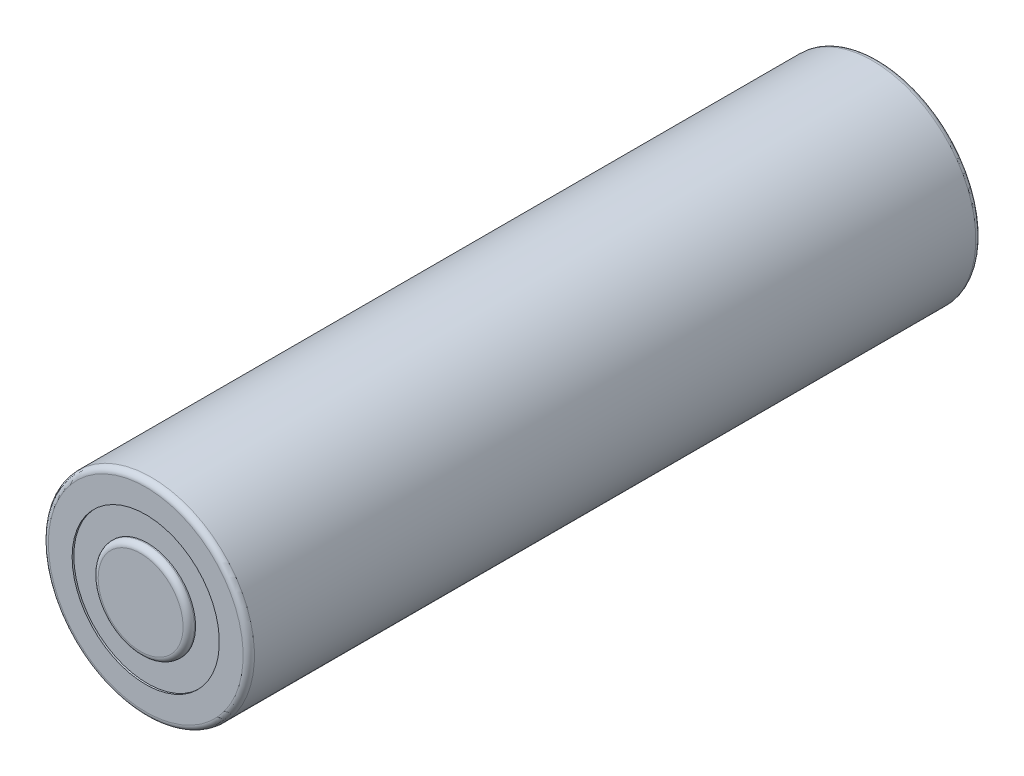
SolidWorks part; units mm, degrees
ref_plane "Front Plane" through (0, 0, 0) normal (0, 0, 1) x (1, 0, 0)
ref_plane "Top Plane" through (0, 0, 0) normal (0, 1, 0) x (1, 0, 0)
ref_plane "Right Plane" through (0, 0, 0) normal (1, 0, 0) x (0, 0, -1)
ref_plane "Plane1" through (0, 15.272, 0) normal (0, -1, 0) x (1, 0, 0)
sketch "Sketch1" plane through (0, 15.272, 0) normal (0, -1, 0) x (1, 0, 0)
  line L0 (-25.1244, 65.15) -> (-28.8744, 65.15)
  line L1 (-28.8744, 65.15) -> (-28.8744, 0.35)
  line L2 (-28.8744, 0.35) -> (-22.3744, 0.35)
  line L3 (-22.3744, 0.35) -> (-22.3744, 0)
  line L4 (-22.3744, 0) -> (-20.2744, 0)
  line L5 (-19.7744, 0.5) -> (-19.7744, 64.2)
  line L6 (-20.2744, 64.7) -> (-22.3744, 64.7)
  line L7 (-22.3744, 64.7) -> (-22.3744, 64.55)
  line L8 (-22.3744, 64.55) -> (-24.6244, 64.55)
  line L9 (-24.6244, 64.55) -> (-24.6244, 64.65)
  line L10 (-28.8744, 65.15) -> (-28.8744, 0) construction
  arc A0 (-20.2744, 0) -> (-19.7744, 0.5) centre (-20.2744, 0.5) ccw
  arc A1 (-19.7744, 64.2) -> (-20.2744, 64.7) centre (-20.2744, 64.2) ccw
  arc A2 (-24.6244, 64.65) -> (-25.1244, 65.15) centre (-25.1244, 64.65) ccw
revolve "Revolve1" add sketch "Sketch1" angle 360 about L10
